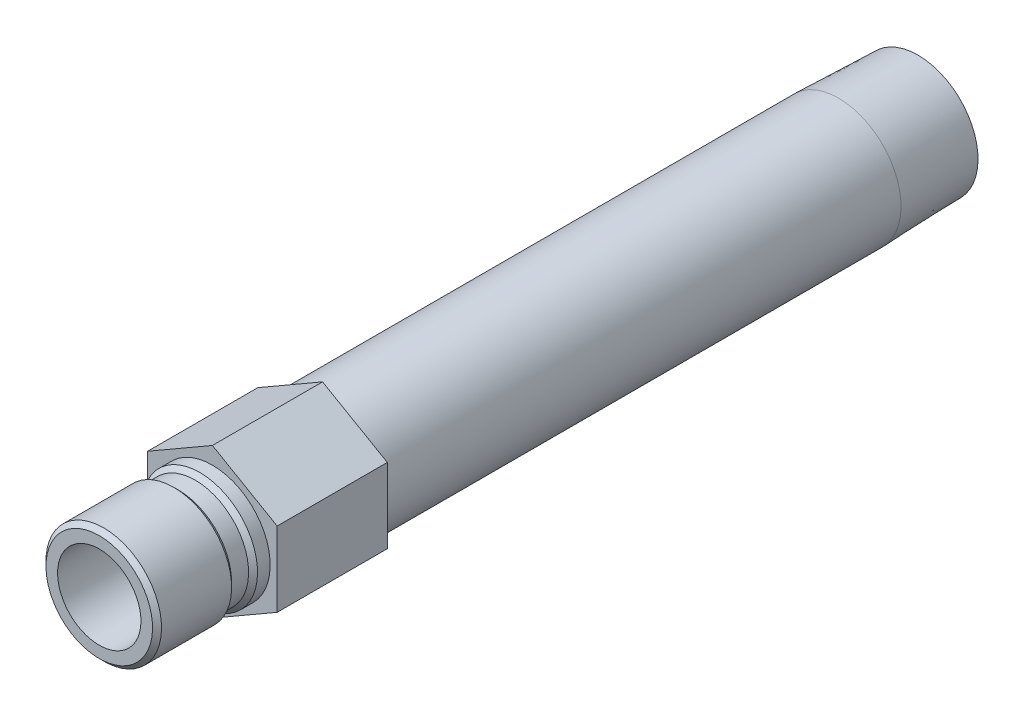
SolidWorks part; units mm, degrees
ref_plane "Front Plane" through (0, 0, 0) normal (0, 0, 1) x (1, 0, 0)
ref_plane "Top Plane" through (0, 0, 0) normal (0, 1, 0) x (1, 0, 0)
ref_plane "Right Plane" through (0, 0, 0) normal (1, 0, 0) x (0, 0, -1)
sketch "Sketch1" plane through (0, 0, 0) normal (1, 0, 0) x (0, 0, -1)
  line L0 (0, 0) -> (-22.479, 0) construction
  line L1 (-19.304, 7.112) -> (-19.304, 9.0932)
  line L2 (-5.8166, 9.0932) -> (-5.8166, 0) construction
  line L3 (-18.542, 9.8552) -> (-6.5786, 9.8552)
  line L4 (0, 10.668) -> (0, 0) construction
  line L5 (-5.8166, 9.0932) -> (-2.921, 9.0932)
  line L6 (-2.159, 9.8552) -> (0, 9.8552)
  line L7 (0, 9.8552) -> (0, 10.668)
  line L8 (-5.8166, 9.0932) -> (-6.5786, 9.8552)
  line L9 (-2.921, 9.0932) -> (-2.159, 9.8552)
  line L10 (-19.304, 9.0932) -> (-18.542, 9.8552)
  line L11 (-19.304, 7.112) -> (-1.524, 7.112)
  line L12 (0, 10.668) -> (106.8324, 10.668)
  line L13 (106.8324, 10.668) -> (120.396, 10.2441)
  line L14 (120.396, 10.2441) -> (120.396, 7.8994)
  line L15 (0, 9.8552) -> (18.796, 9.8552) construction
  line L16 (18.796, 9.8552) -> (18.796, 0) construction
  line L17 (18.796, 0) -> (0, 0) construction
  line L18 (-1.524, 7.112) -> (-1.1053, 7.8994)
  line L19 (-1.1053, 7.8994) -> (120.396, 7.8994)
  dimension "D1" = 19.304
  dimension "D2" = 2.8956
  dimension "D3" = 0.762
  dimension "D4" = 45
  dimension "D5" = 13.4874
  dimension "D6" = 45
  dimension "D7" = 1.79
  dimension "D8" = 13.5636
  dimension "D9" = 139.7
  dimension "D10" = 3.175
  dimension "D11" = 38.1
  dimension "D12" = 14.224
  dimension "D13" = 21.336
  dimension "D14" = 19.7104
  dimension "D15" = 15.7988
  dimension "D16" = 118
  dimension "D17" = 17.78
revolve "Revolve1" add sketch "Sketch1" angle 360 about L0
sketch "Sketch2" plane through (0, 0, 0) normal (0, 0, 1) x (1, 0, 0)
  line L1 (-11.049, 6.3791) -> (-11.049, -6.3791)
  line L2 (-11.049, -6.3791) -> (0, -12.7583)
  line L3 (0, -12.7583) -> (11.049, -6.3791)
  line L4 (11.049, -6.3791) -> (11.049, 6.3791)
  line L5 (11.049, 6.3791) -> (0, 12.7583)
  line L6 (0, 12.7583) -> (-11.049, 6.3791)
  circle A0 centre (0, 0) radius 11.049 construction
  circle A1 centre (0, 0) radius 7.112 construction
  circle A2 centre (0, 0) radius 7.112
  dimension "D1" = 22.098
extrude "Boss-Extrude1" add sketch "Sketch2" against normal up to vertex (18.796 mm away) from vertex at 0
